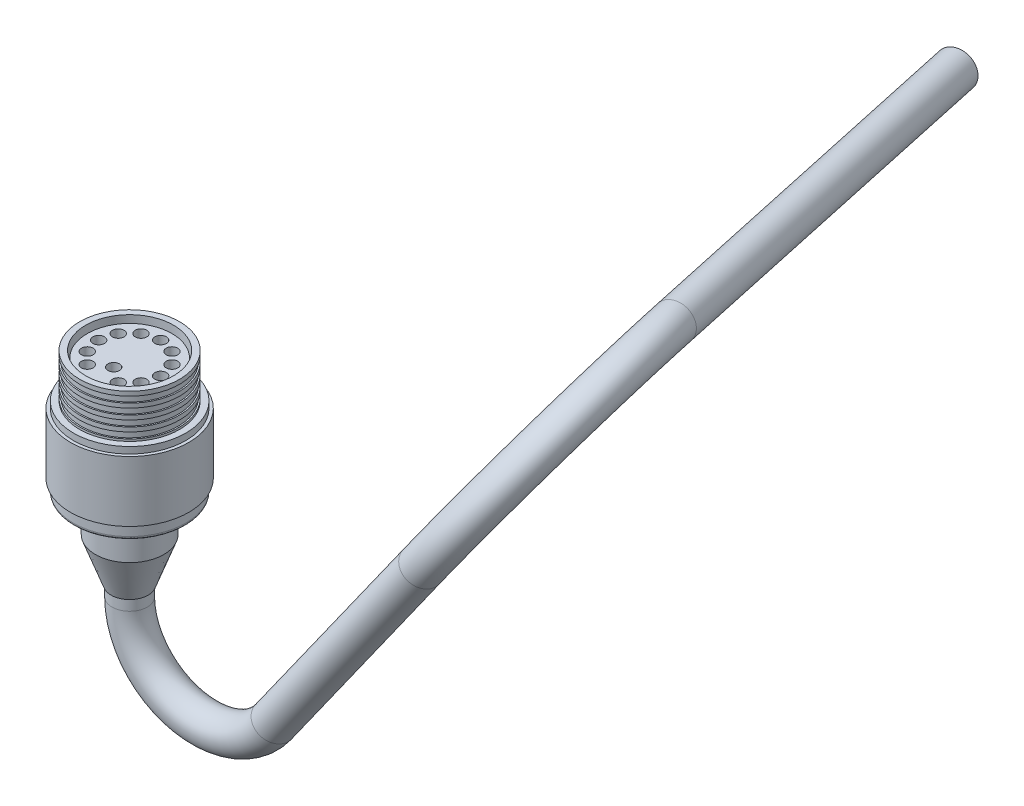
SolidWorks part; units mm, degrees
ref_plane "Front" through (0, 0, 0) normal (0, 0, 1) x (1, 0, 0)
ref_plane "Top" through (0, 0, 0) normal (0, 1, 0) x (1, 0, 0)
ref_plane "Right" through (0, 0, 0) normal (1, 0, 0) x (0, 0, -1)
sketch "Sketch1" plane through (0, 0, 0) normal (0, 1, 0) x (1, 0, 0)
  line L5 (-5.8292, -10.0965) -> (5.8292, -10.0965) construction
  line L6 (5.8292, -10.0965) -> (11.6584, 0) construction
  line L7 (11.6584, 0) -> (5.8292, 10.0965)
  line L8 (5.8292, 10.0965) -> (-5.8292, 10.0965)
  line L9 (-5.8292, 10.0965) -> (-11.6584, 0)
  line L10 (-11.6584, 0) -> (-5.8292, -10.0965)
  circle A0 centre (0, 0) radius 10.0965
  dimension "D1" = 20.193
extrude "Extrude1" add sketch "Sketch1" along normal blind 17.145
sketch "Sketch3" plane through (0, 17.145, 0) normal (0, 1, 0) x (-1, 0, 0)
  circle A0 centre (0, 0) radius 12.5
  dimension "D1" = 25
extrude "Extrude3" add sketch "Sketch3" along normal blind 28
sketch "Sketch12" plane through (0, 0, 0) normal (0, -1, 0) x (1, 0, 0)
  circle A1 centre (0, 0) radius 10.0965
  circle A2 centre (0, 0) radius 10.0965
  dimension "D1" = 0
extrude "Boss-Extrude1" add sketch "Sketch12" along normal blind 12.7 draft 20
sketch "Sketch13" plane through (0, -12.7, 0) normal (0, -1, 0) x (1, 0, 0)
  circle A0 centre (0, 0) radius 5.207
  dimension "D1" = 10.414
extrude "Boss-Extrude2" add sketch "Sketch13" along normal blind 3.175
sketch "Sketch7" plane through (0, 45.145, 0) normal (0, 1, 0) x (1, 0, 0)
  circle A0 centre (0, 9.144) radius 1.7145
  circle A1 centre (0, 0) radius 9.144 construction
  dimension "D1" = 3.429
  dimension "D2" = 18.288
extrude "Extrude5" cut sketch "Sketch7" against normal blind 12
pattern_circular "CirPattern1" count 12 over 360 about axis through (0, 0, 0) along (0, 1, 0) of "Extrude5"
sketch "Sketch8" plane through (0, 45.145, 0) normal (0, 1, 0) x (1, 0, 0)
  circle A0 centre (0, -4.6898) radius 1.7145
  circle A1 centre (0, 0) radius 12.5 construction
  dimension "D1" = 3.429
  dimension "D3" = 6.0957
  dimension "D2" = 4.6898
extrude "Extrude6" cut sketch "Sketch8" against normal blind 12
sketch "Sketch14" [suppressed] plane through (0, -15.875, 0) normal (0, -1, 0) x (1, 0, 0)
  line L0 (-12.7, 8.8801) -> (-12.7, -15.3002) construction
  circle A1 centre (0, 0) radius 5.207
  circle A2 centre (0, 0) radius 5.207
  dimension "D2" = 12.7
  dimension "D1" = 0
revolve "Revolve1" [suppressed] add sketch "Sketch14" angle 90 about L0
sketch "Sketch9" plane through (0, 0, 0) normal (0, 0, 1) x (1, 0, 0)
  line L0 (12.954, 14.5632) -> (11.6205, 14.5632)
  line L1 (12.954, 47.0752) -> (12.954, 15.444)
  line L2 (12.954, 10.2452) -> (15.5608, 10.2452)
  line L3 (16.5608, 11.2452) -> (16.5608, 14.4476)
  line L4 (14.732, 47.0752) -> (14.732, 45.8052)
  line L5 (16.5608, 34.2452) -> (14.732, 34.2452)
  line L6 (14.732, 47.0752) -> (12.954, 47.0752)
  line L7 (11.6205, 14.5632) -> (11.6205, 15.444)
  line L8 (0, 0) -> (0, -20.1424) construction
  line L10 (16.5608, 32.3208) -> (17.4625, 32.3208)
  line L11 (17.4625, 32.3208) -> (17.4625, 14.4476)
  line L12 (17.4625, 14.4476) -> (16.5608, 14.4476)
  line L13 (16.5608, 32.3208) -> (16.5608, 34.2452)
  line L14 (11.6205, 15.444) -> (12.954, 15.444)
  line L15 (12.954, 14.5632) -> (12.954, 10.2452)
  line L16 (14.732, 45.8052) -> (14.3243, 45.8052)
  line L17 (14.3243, 45.8052) -> (14.3243, 44.0272)
  line L18 (14.3243, 44.0272) -> (14.732, 44.0272)
  line L19 (14.732, 42.7572) -> (14.3243, 42.7572)
  line L20 (14.3243, 42.7572) -> (14.3243, 40.9792)
  line L21 (14.3243, 40.9792) -> (14.732, 40.9792)
  line L22 (14.732, 39.7092) -> (14.3243, 39.7092)
  line L23 (14.3243, 39.7092) -> (14.3243, 37.9312)
  line L24 (14.3243, 37.9312) -> (14.732, 37.9312)
  line L25 (14.732, 36.6612) -> (14.3243, 36.6612)
  line L26 (14.3243, 36.6612) -> (14.3243, 34.8832)
  line L27 (14.3243, 34.8832) -> (14.732, 34.8832)
  line L28 (14.732, 44.0272) -> (14.732, 42.7572)
  line L29 (14.732, 40.9792) -> (14.732, 39.7092)
  line L30 (14.732, 37.9312) -> (14.732, 36.6612)
  line L31 (14.732, 34.8832) -> (14.732, 34.2452)
  arc A0 (16.5608, 11.2452) -> (15.5608, 10.2452) centre (15.5608, 11.2452) cw
  point P15 (16.5608, 10.2452)
  dimension "D5" = 1
  dimension "D1" = 36.83
  dimension "D2" = 12.83
  dimension "D3" = 33.1216
  dimension "D4" = 29.464
  dimension "D6" = 25.908
  dimension "D7" = 24
  dimension "D8" = 34.925
  dimension "D9" = 23.241
  dimension "D10" = 4.318
  dimension "D11" = 1.27
  dimension "D12" = 1.778
  dimension "D13" = 0.8808
revolve "DLSA-M Revolve" add sketch "Sketch9" angle 360 about L8
sketch "Sketch15" plane through (0, -15.875, 0) normal (0, -1, 0) x (1, 0, 0)
  line L0 (23.752, 28.5551) -> (22.1303, -2.3882) construction
  line L1 (0, 0) -> (0, 16.174) construction
  circle A1 centre (0, 0) radius 5.207
  circle A2 centre (0, 0) radius 5.207
  dimension "D2" = 22.225
  dimension "D3" = 3
  dimension "D1" = 0
revolve "Revolve2" add sketch "Sketch15" angle 145 about L0
sketch "Sketch16" plane through (-0.1468, -0.21, 0.0077) normal (0.5728, 0.8192, -0.03) x (0.8197, -0.5727, 0.012)
  circle A1 centre (49.4616, 2.7163) radius 5.207
  circle A2 centre (49.4616, 2.7163) radius 5.207
  dimension "D1" = 0
extrude "Boss-Extrude3" add sketch "Sketch16" along normal blind 72.2313
sketch "Sketch17" plane through (41.2266, 58.9584, -2.1606) normal (0.5728, 0.8192, -0.03) x (0.8196, -0.5717, 0.039)
  line L0 (19.8253, 47.1141) -> (61.8021, 56.3907) construction
  line L1 (49.3698, 4.0563) -> (87.445, 4.0563) construction
  circle A1 centre (49.3698, 4.0563) radius 5.207
  circle A2 centre (49.3698, 4.0563) radius 5.207
  dimension "D2" = 48.4187
  dimension "D3" = 12.462
  dimension "D1" = 0
revolve "Revolve3" add sketch "Sketch17" angle 99 about L0
sketch "Sketch18" plane through (-7.4877, -1.5457, -28.9608) normal (-0.25, -0.0516, -0.9669) x (-0.7413, -0.6321, 0.2254)
  circle A1 centre (-134.691, -12.3368) radius 5.207
  circle A2 centre (-134.691, -12.3368) radius 5.207
  dimension "D1" = 0
extrude "Boss-Extrude4" add sketch "Sketch18" along normal blind 115.8875
